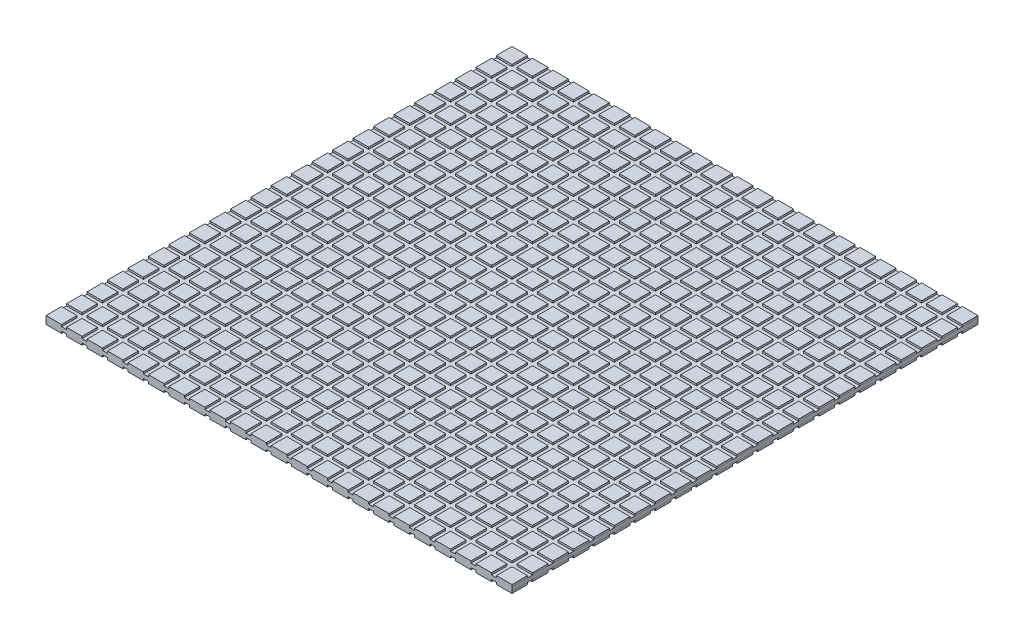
SolidWorks part; units mm, degrees
ref_plane "Front Plane" through (0, 0, 0) normal (0, 0, 1) x (1, 0, 0)
ref_plane "Top Plane" through (0, 0, 0) normal (0, 1, 0) x (1, 0, 0)
ref_plane "Right Plane" through (0, 0, 0) normal (1, 0, 0) x (0, 0, -1)
sketch "Sketch1" plane through (0, 0, 0) normal (0, 1, 0) x (1, 0, 0)
  line L1 (150, -150) -> (-150, -150)
  line L2 (150, -150) -> (150, 150)
  line L3 (150, 150) -> (-150, 150)
  line L4 (-150, -150) -> (-150, 150)
  line L5 (150, -150) -> (-150, 150) construction
  line L6 (150, 150) -> (-150, -150) construction
  point P0 (0, 0)
  dimension "D1" = 300
extrude "Boss-Extrude1" add sketch "Sketch1" along normal mid plane 2.5
sketch "Sketch2" plane through (0, 0, 0) normal (0, 1, 0) x (1, 0, 0)
  line L0 (-150, 150) -> (-150, -150) construction
  line L1 (-150, -150) -> (-140, -150)
  line L2 (-150, -150) -> (-150, -140)
  line L3 (-150, -140) -> (-140, -140)
  line L4 (-140, -150) -> (-140, -140)
  line L5 (-150, -150) -> (-140, -140) construction
  line L6 (-150, -140) -> (-140, -150) construction
  line L7 (-150, -150) -> (150, -150) construction
  point P0 (-145, -145)
  dimension "D1" = 10
extrude "Boss-Extrude2" add sketch "Sketch2" along normal mid plane 5
pattern_linear "LPattern4" count 23 spacing 13.1818 along (0, 0, -1) of "Boss-Extrude2"
pattern_linear "LPattern5" count 23 spacing 13.1818 along (1, 0, 0) of "LPattern4", "Boss-Extrude2"
